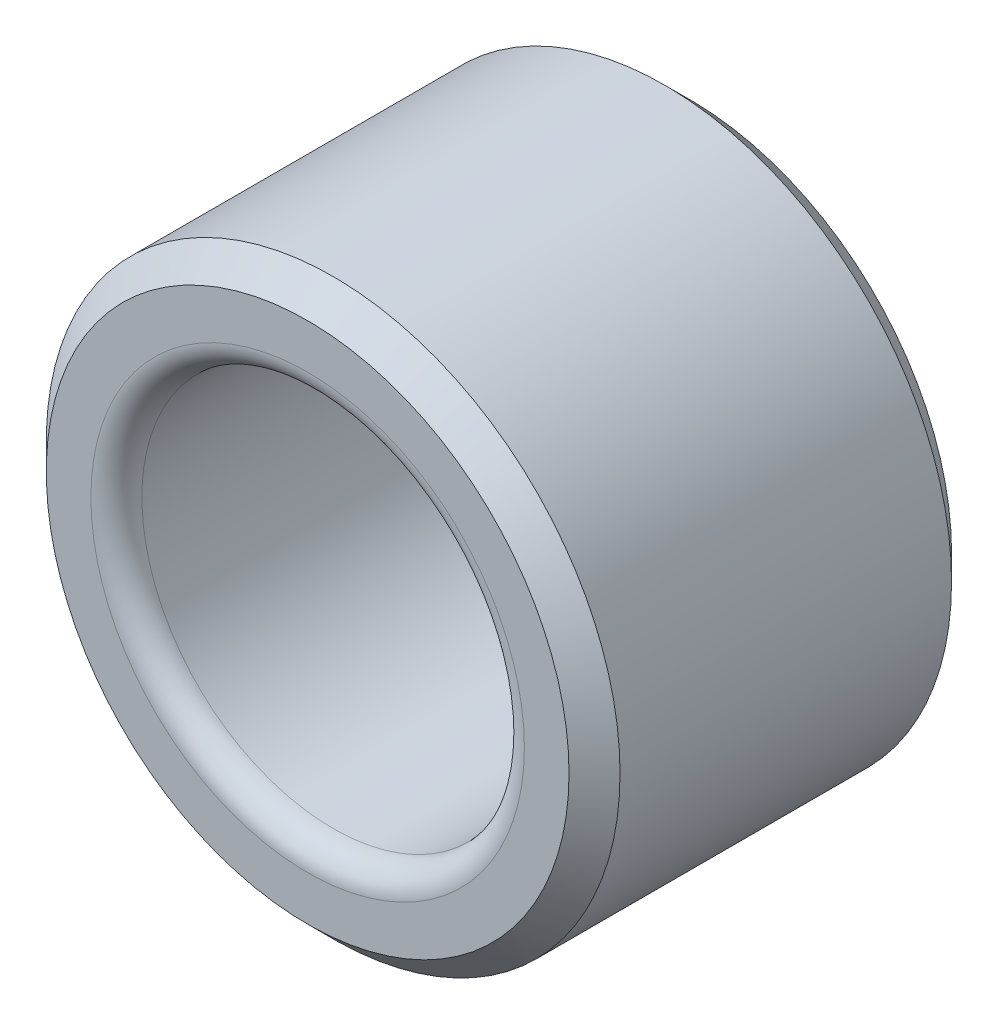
SolidWorks part; units mm, degrees
ref_plane "Front Plane" through (0, 0, 0) normal (0, 0, 1) x (1, 0, 0)
ref_plane "Top Plane" through (0, 0, 0) normal (0, 1, 0) x (1, 0, 0)
ref_plane "Right Plane" through (0, 0, 0) normal (1, 0, 0) x (0, 0, -1)
sketch "Sketch1" plane through (0, 0, 0) normal (0, 0, 1) x (1, 0, 0)
  circle A0 centre (0, 0) radius 6
  circle A1 centre (0, 0) radius 9
  dimension "D1" = 12
  dimension "D2" = 18
extrude "Extrude1" add sketch "Sketch1" along normal blind 12
chamfer "Chamfer1" distance 0.8 angle 45 2 edges at (9, 0, 12) (9, 0, 0)
fillet "Fillet1" radius 0.8 2 edges at (6, 0, 12) (6, 0, 0)
